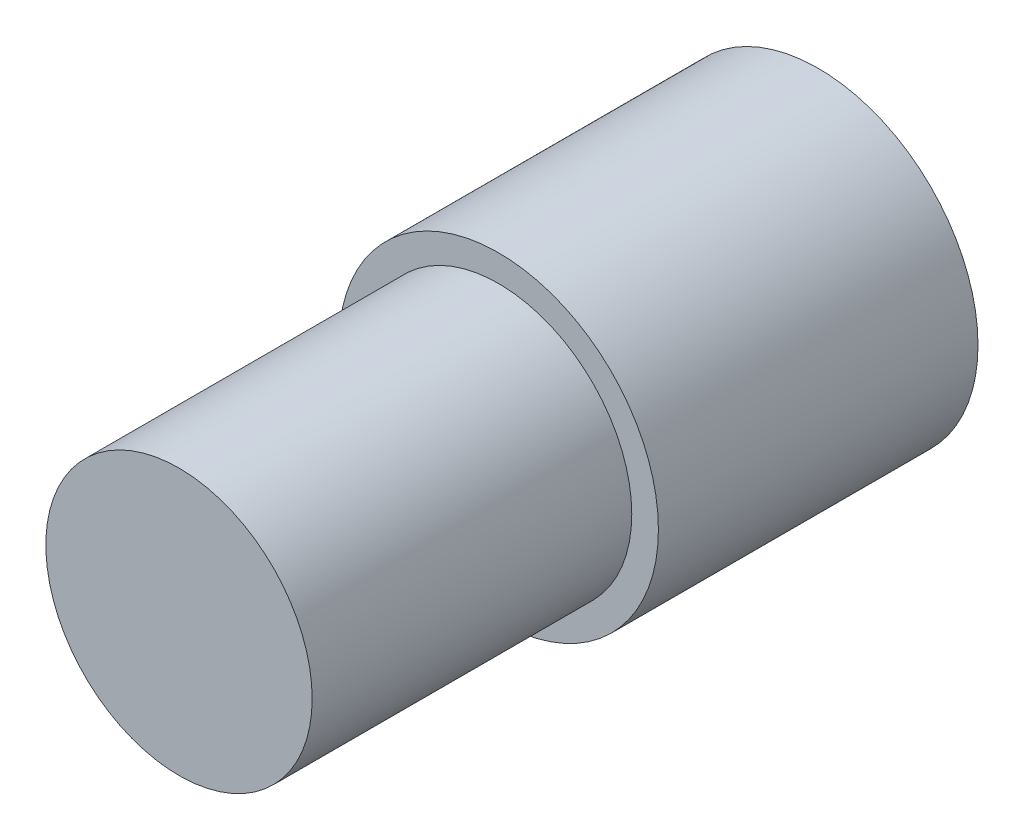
SolidWorks part; units mm, degrees
ref_plane "Alzado" through (0, 0, 0) normal (0, 0, 1) x (1, 0, 0)
ref_plane "Planta" through (0, 0, 0) normal (0, 1, 0) x (1, 0, 0)
ref_plane "Vista lateral" through (0, 0, 0) normal (1, 0, 0) x (0, 0, -1)
sketch "Croquis1" plane through (0, 0, 0) normal (0, 0, 1) x (1, 0, 0)
  circle A0 centre (0, 0) radius 6
  dimension "D1" = 12
extrude "Saliente-Extruir1" add sketch "Croquis1" along normal blind 12
sketch "Croquis2" plane through (0, 0, 12) normal (0, 0, 1) x (1, 0, 0)
  circle A0 centre (0, 0) radius 5
  dimension "D1" = 10
extrude "Saliente-Extruir2" add sketch "Croquis2" along normal blind 12
